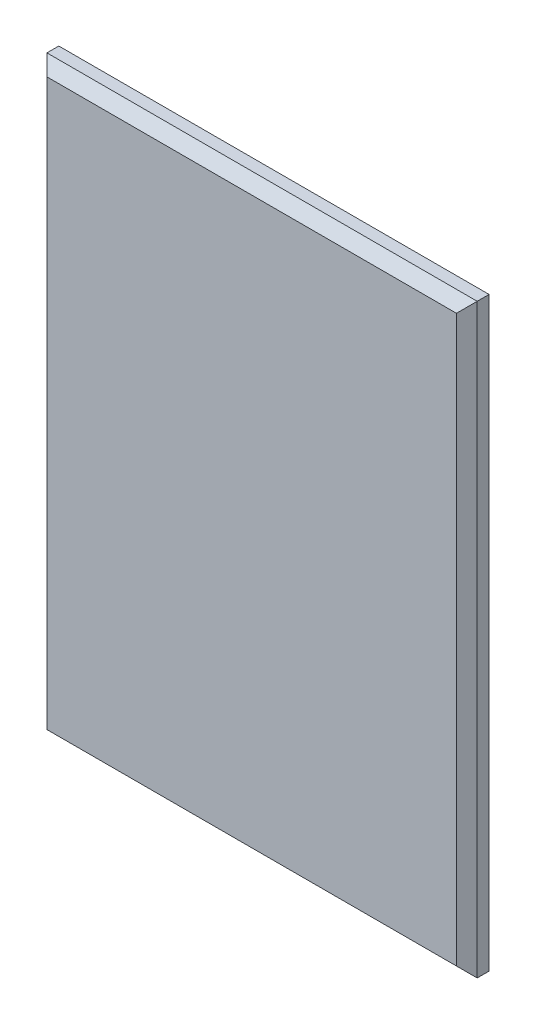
SolidWorks part; units mm, degrees
ref_plane "Front Plane" through (0, 0, 0) normal (0, 0, 1) x (1, 0, 0)
ref_plane "Top Plane" through (0, 0, 0) normal (0, 1, 0) x (1, 0, 0)
ref_plane "Right Plane" through (0, 0, 0) normal (1, 0, 0) x (0, 0, -1)
sketch "Sketch1" plane through (0, 0, 0) normal (0, 0, 1) x (1, 0, 0)
  line L1 (0, 0) -> (368.3, 0)
  line L2 (0, 0) -> (0, 501.65)
  line L3 (0, 501.65) -> (368.3, 501.65)
  line L4 (368.3, 0) -> (368.3, 501.65)
  dimension "D1" = 501.65
  dimension "D2" = 368.3
extrude "Boss-Extrude1" add sketch "Sketch1" along normal blind 19.05
chamfer "Chamfer1" distance 8.89 angle 45 4 edges at (184.15, 501.65, 19.05) (368.3, 250.825, 19.05) (184.15, 0, 19.05) (0, 250.825, 19.05)
sketch "Sketch2" plane through (0, 0, 19.05) normal (0, 0, 1) x (1, 0, 0)
  line L0 (359.41, 400.05) -> (8.89, 400.05) construction
  line L1 (359.41, 8.89) -> (359.41, 492.76) construction
  line L2 (8.89, 492.76) -> (8.89, 8.89) construction
  line L3 (0, 501.65) -> (368.3, 501.65) construction
  circle A0 centre (72.39, 400.05) radius 12.8859 construction
  circle A1 centre (295.91, 400.05) radius 12.2988 construction
  point P8 (72.39, 400.05)
  point P9 (295.91, 400.05)
  dimension "D1" = 101.6
  dimension "D2" = 63.5
  dimension "D3" = 63.5
